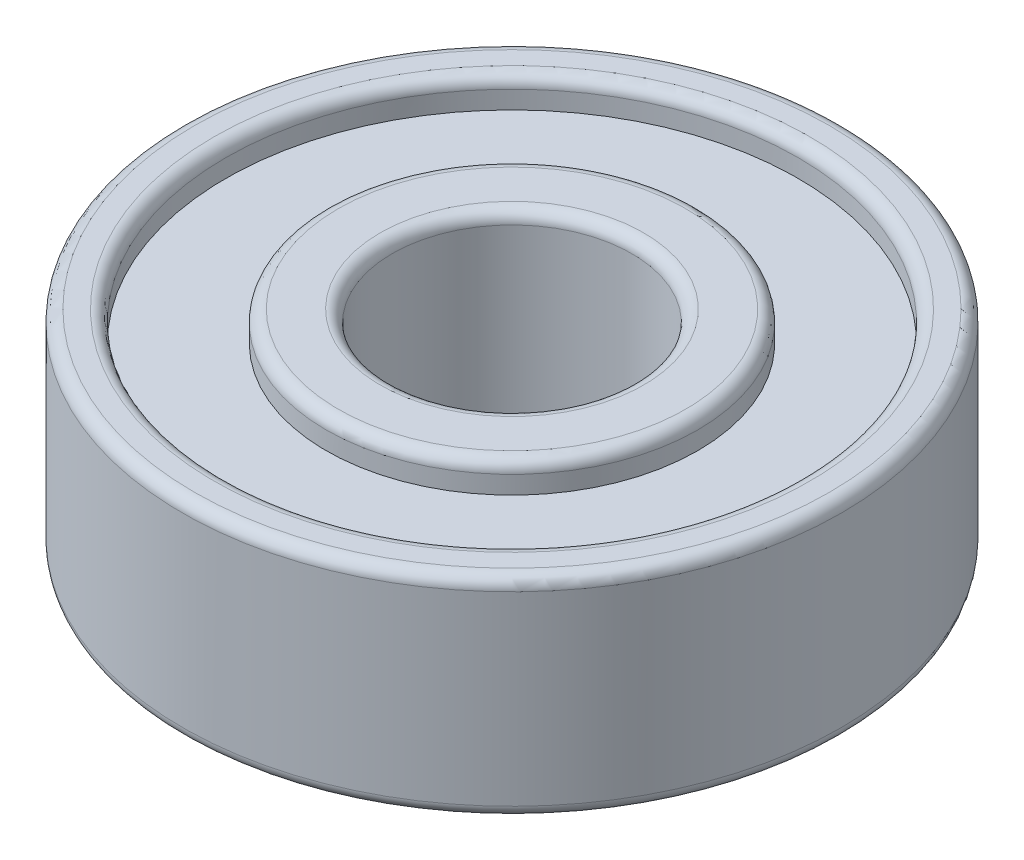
SolidWorks part; units mm, degrees
ref_plane "Face" through (0, 0, 0) normal (0, 0, 1) x (1, 0, 0)
ref_plane "Dessus" through (0, 0, 0) normal (0, 1, 0) x (1, 0, 0)
ref_plane "Droite" through (0, 0, 0) normal (1, 0, 0) x (0, 0, -1)
sketch "Esquisse1" plane through (0, 0, 0) normal (0, 0, 1) x (1, 0, 0)
  line L0 (0, 0) -> (0, 33.029) construction
  line L1 (9.55, 0) -> (11, 0)
  line L2 (11, 0) -> (11, 7)
  line L3 (11, 7) -> (9.55, 7)
  line L4 (9.55, 7) -> (9.55, 6)
  line L5 (9.55, 6) -> (6.2, 6)
  line L6 (6.2, 6) -> (6.2, 7)
  line L7 (6.2, 7) -> (4, 7)
  line L8 (4, 7) -> (4, 0)
  line L9 (4, 0) -> (6.2, 0)
  line L10 (6.2, 0) -> (6.2, 1)
  line L11 (6.2, 1) -> (9.55, 1)
  line L12 (9.55, 1) -> (9.55, 0)
  dimension "D1" = 8
  dimension "D2" = 12.4
  dimension "D3" = 19.1
  dimension "D4" = 22
  dimension "D5" = 7
  dimension "D6" = 1
revolve "Révolution1" add sketch "Esquisse1" angle 360 about L0
fillet "Congé1" radius 0.4 8 edges at (6.2, 7, 0) (4, 7, 0) (11, 7, 0) (9.55, 7, 0) (4, 0, 0) (6.2, 0, 0) (9.55, 0, 0) (11, 0, 0)
